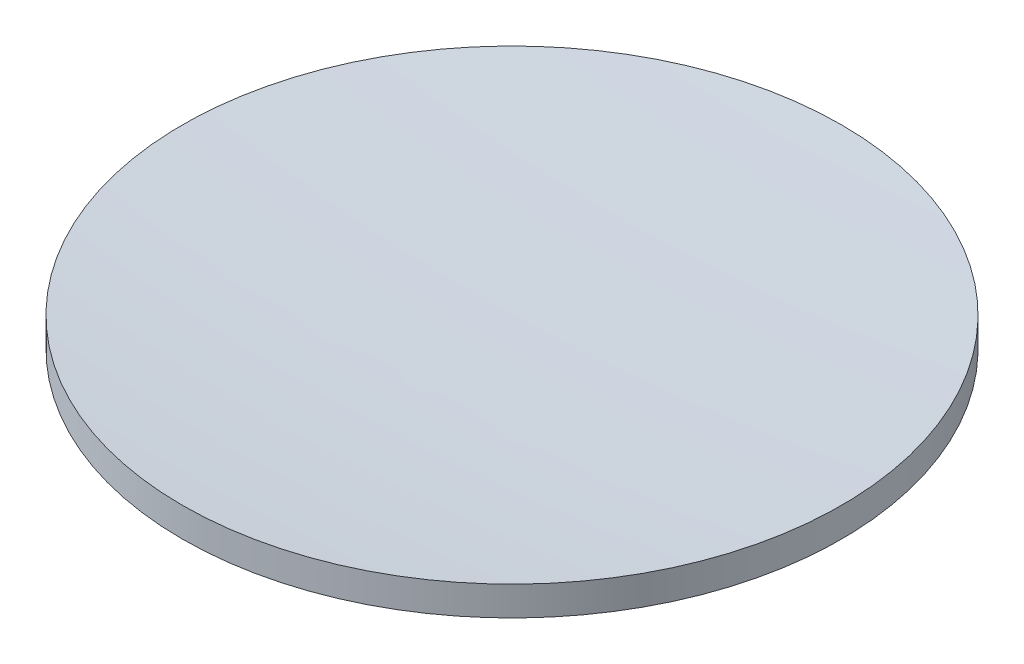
SolidWorks part; units mm, degrees
ref_plane "Front Plane" through (0, 0, 0) normal (0, 0, 1) x (1, 0, 0)
ref_plane "Top Plane" through (0, 0, 0) normal (0, 1, 0) x (1, 0, 0)
ref_plane "Right Plane" through (0, 0, 0) normal (1, 0, 0) x (0, 0, -1)
sketch "Sketch1" plane through (0, 0, 0) normal (0, 1, 0) x (1, 0, 0)
  circle A0 centre (0, 0) radius 28.575
  dimension "D1" = 57.15
extrude "Extrude1" add sketch "Sketch1" along normal blind 2.54
sketch "Sketch2" plane through (0, 0, 0) normal (1, 0, 0) x (0, 0, -1)
  line L0 (0, 0) -> (0, 2.54) construction
  line L1 (28.575, 2.54) -> (-28.575, 2.54) construction
  line L2 (0, 1.397) -> (11.3393, 1.397) construction
  line L3 (0, 1.397) -> (0, 2.54)
  line L4 (0, 2.54) -> (-28.575, 2.54)
  arc A0 (-28.575, 2.54) -> (0, 1.397) centre (0, 359.156) ccw
  dimension "D1" = 1.143
revolve "Cut-Revolve1" cut sketch "Sketch2" angle 360 about L0
